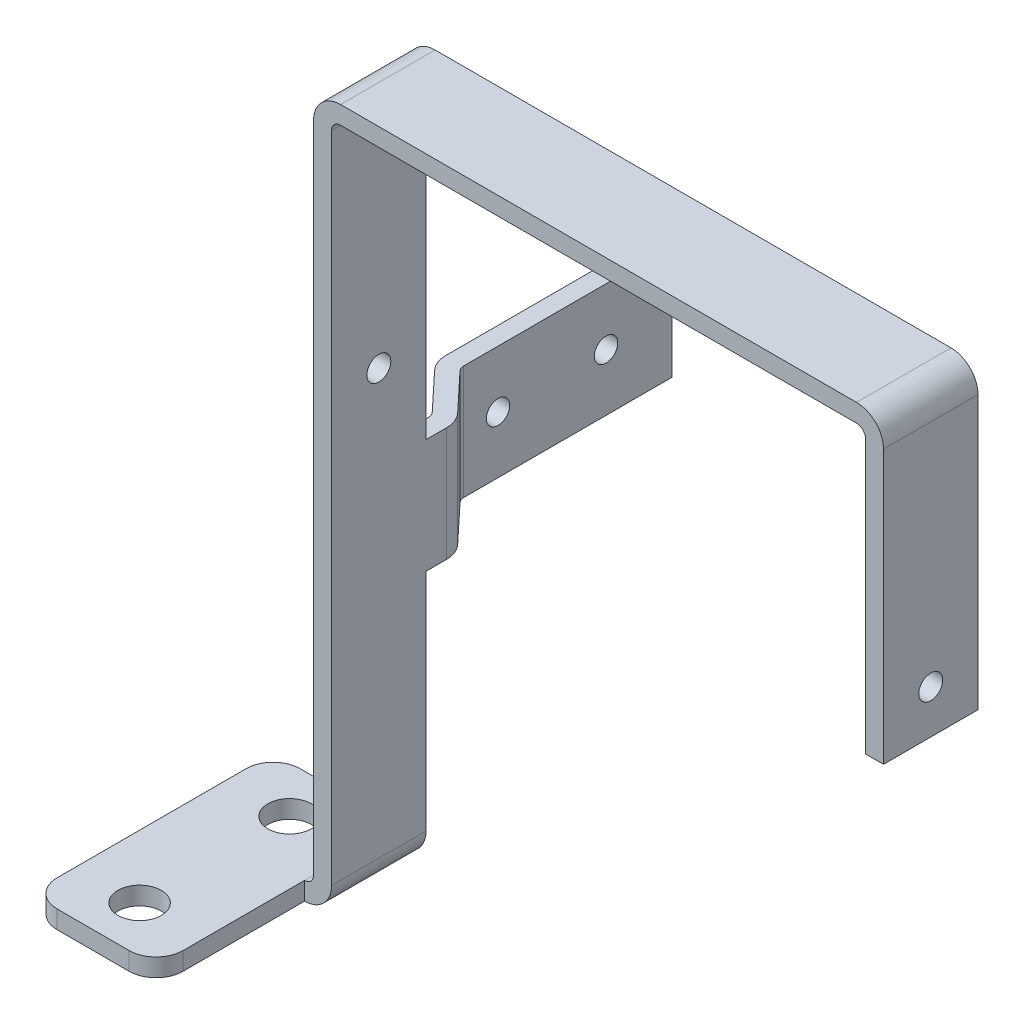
SolidWorks part; units mm, degrees
ref_plane "Front Plane" through (0, 0, 0) normal (0, 0, 1) x (1, 0, 0)
ref_plane "Top Plane" through (0, 0, 0) normal (0, 1, 0) x (1, 0, 0)
ref_plane "Right Plane" through (0, 0, 0) normal (1, 0, 0) x (0, 0, -1)
sketch "Sketch1" plane through (0, 0, 0) normal (0, 0, 1) x (1, 0, 0)
  line L0 (-24.13, 0) -> (-24.13, 25.4)
  line L1 (55, 0) -> (-55, 0) construction
  line L2 (-24.13, 25.4) -> (0, 25.4)
  line L3 (24.13, 25.4) -> (24.13, 0)
  line L4 (0, -55) -> (0, 55) construction
  line L5 (0, 25.4) -> (24.13, 25.4)
  line L6 (-24.13, 0) -> (-24.13, -33.02)
  line L7 (-24.13, -33.02) -> (-35.56, -33.02)
  dimension "D1" = 48.26
  dimension "D2" = 25.4
  dimension "D3" = 58.42
  dimension "D4" = 11.43
extrude "Extrude-Thin1" add sketch "Sketch1" against normal mid plane 8.001 thin
ref_plane "Plane1" through (0, -3.556, 0) normal (0, 1, 0) x (1, 0, 0)
sketch "Sketch5" plane through (0, -3.556, 0) normal (0, 1, 0) x (1, 0, 0)
  line L0 (-24.13, 4.0005) -> (-24.13, 6.0325)
  line L1 (-24.13, 6.0325) -> (-27.94, 10.0965)
  line L2 (-27.94, 10.0965) -> (-27.94, 28.6385)
  dimension "D1" = 2.032
  dimension "D2" = 3.81
  dimension "D3" = 4.064
  dimension "D4" = 18.542
extrude "Extrude-Thin2" add sketch "Sketch5" against normal blind 9.652 thin
sketch "Sketch6" plane through (-27.94, 0, 0) normal (-1, 0, 0) x (0, 0, 1)
  line L0 (-28.6385, -8.382) -> (-23.0505, -8.382) construction
  line L1 (-28.6385, -13.208) -> (-28.6385, -3.556) construction
  line L2 (-23.0505, -8.382) -> (-13.9065, -8.382) construction
  circle A0 centre (-23.0505, -8.382) radius 0.9906
  circle A1 centre (-13.9065, -8.382) radius 0.9906
  dimension "D3" = 1.9812
  dimension "D1" = 5.588
  dimension "D2" = 9.144
extrude "Cut-Extrude3" cut sketch "Sketch6" against normal through all
fillet "Fillet1" radius 0.762 5 edges at (22.606, 23.876, 0) (-22.606, 23.876, 0) (-24.13, -33.02, 0) (-26.416, -8.382, -10.6992) (-24.13, -8.382, -6.0325)
fillet "Fillet2" radius 2.286 5 edges at (24.13, 25.4, 0) (-24.13, 25.4, 0) (-22.606, -34.544, 0) (-27.94, -8.382, -10.0965) (-22.606, -8.382, -6.6352)
sketch "Sketch2" plane through (0, -33.02, 0) normal (0, 1, 0) x (1, 0, 0)
  line L0 (-24.892, -4.0005) -> (-24.892, 4.0005) construction
  line L1 (-35.56, 4.0005) -> (-24.892, 4.0005)
  line L2 (-35.56, 4.0005) -> (-35.56, -16.5735)
  line L3 (-35.56, -16.5735) -> (-24.892, -16.5735)
  line L4 (-24.892, 4.0005) -> (-24.892, -16.5735)
  dimension "D1" = 20.574
extrude "Boss-Extrude1" add sketch "Sketch2" against normal up to surface (1.524 mm away)
sketch "Sketch3" plane through (0, -33.02, 0) normal (0, 1, 0) x (1, 0, 0)
  line L0 (-30.226, 4.0005) -> (-30.226, -16.5735) construction
  line L1 (-24.892, 4.0005) -> (-35.56, 4.0005) construction
  line L2 (-35.56, -16.5735) -> (-24.892, -16.5735) construction
  line L3 (-30.226, -6.2865) -> (-40.4257, -6.2865) construction
  circle A0 centre (-30.226, 0.0635) radius 1.8415
  circle A1 centre (-30.226, -12.6365) radius 1.8415
  point P12 (-30.226, -1.778)
  point P13 (-30.226, -10.795)
  dimension "D1" = 3.683
  dimension "D2" = 9.017
extrude "Cut-Extrude1" cut sketch "Sketch3" against normal through all
fillet "Fillet3" radius 2.286 3 edges at (-24.892, -33.782, 16.5735) (-35.56, -33.782, 16.5735) (-35.56, -33.782, -4.0005)
sketch "Sketch4" plane through (24.13, 0, 0) normal (1, 0, 0) x (0, 0, -1)
  line L0 (0, 0) -> (0, 3.683) construction
  circle A0 centre (0, 3.683) radius 1.016
  dimension "D2" = 2.032
  dimension "D1" = 3.683
extrude "Cut-Extrude2" cut sketch "Sketch4" against normal through all
